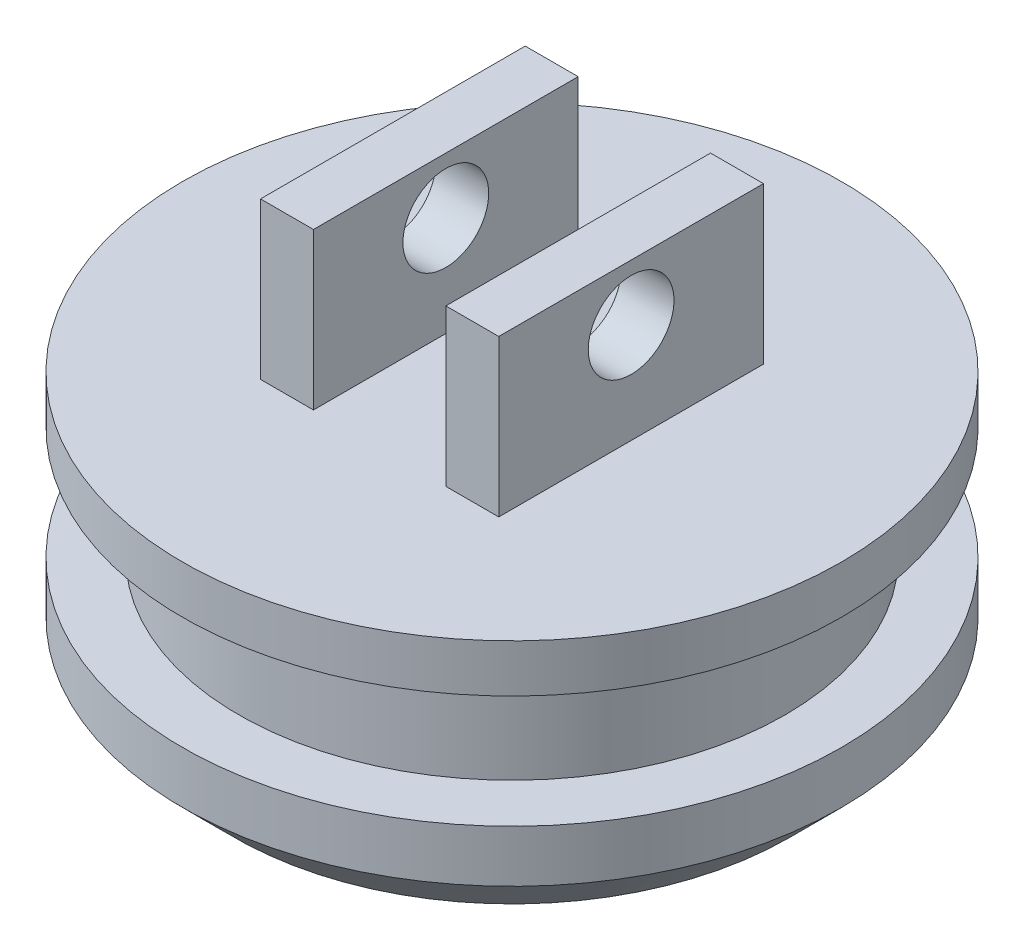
SolidWorks part; units mm, degrees
ref_plane "Front Plane" through (0, 0, 0) normal (0, 0, 1) x (1, 0, 0)
ref_plane "Top Plane" through (0, 0, 0) normal (0, 1, 0) x (1, 0, 0)
ref_plane "Right Plane" through (0, 0, 0) normal (1, 0, 0) x (0, 0, -1)
sketch "Sketch1" plane through (0, 0, 0) normal (0, 0, 1) x (1, 0, 0)
  line L0 (0, 4.292) -> (-15.8115, 4.292)
  line L1 (-15.8115, 4.292) -> (-15.8115, 1.9971)
  line L2 (-15.8115, 1.9971) -> (-13.1064, 1.9971)
  line L3 (-13.1064, 1.9971) -> (-13.1064, -3.4131)
  line L4 (-13.1064, -3.4131) -> (-15.8115, -3.4131)
  line L5 (-15.8115, -3.4131) -> (-15.8115, -8.408)
  line L6 (-15.8115, -8.408) -> (0, -8.408)
  line L7 (0, -8.408) -> (0, 4.292)
  point P2 (-13.1064, -0.708)
  dimension "D1" = 12.7
  dimension "D2" = 15.8115
  dimension "D3" = 5.4102
  dimension "D4" = 2.7051
  dimension "D5" = 5
revolve "Revolve1" add sketch "Sketch1" angle 360 about L7
sketch "Sketch2" plane through (0, 4.292, 0) normal (0, 1, 0) x (1, 0, 0)
  line L0 (0, 0) -> (-3.175, 0) construction
  line L1 (-5.715, 6.35) -> (-3.175, 6.35)
  line L2 (-5.715, 6.35) -> (-5.715, -6.35)
  line L3 (-5.715, -6.35) -> (-3.175, -6.35)
  line L4 (-3.175, 6.35) -> (-3.175, -6.35)
  dimension "D1" = 3.175
  dimension "D2" = 2.54
  dimension "D3" = 12.7
extrude "BoltTab" add sketch "Sketch2" along normal blind 7.5
sketch "Sketch3" plane through (-5.715, 0, 0) normal (-1, 0, 0) x (0, 0, 1)
  line L0 (-6.35, 4.292) -> (6.35, 4.292) construction
  line L1 (0, 9.094) -> (0, 4.292) construction
  line L2 (-6.35, 11.792) -> (6.35, 11.792) construction
  circle A0 centre (0, 9.094) radius 2.0574
  dimension "D2" = 4.1148
  dimension "D1" = 2.698
extrude "BoltHole" cut sketch "Sketch3" against normal blind 10
mirror "Mirror1" about plane through (0, 0, 0) normal (1, 0, 0) of "BoltHole", "BoltTab"
chamfer "Chamfer1" distance 2.5 angle 45 1 edges at (15.8115, -8.408, 0)
